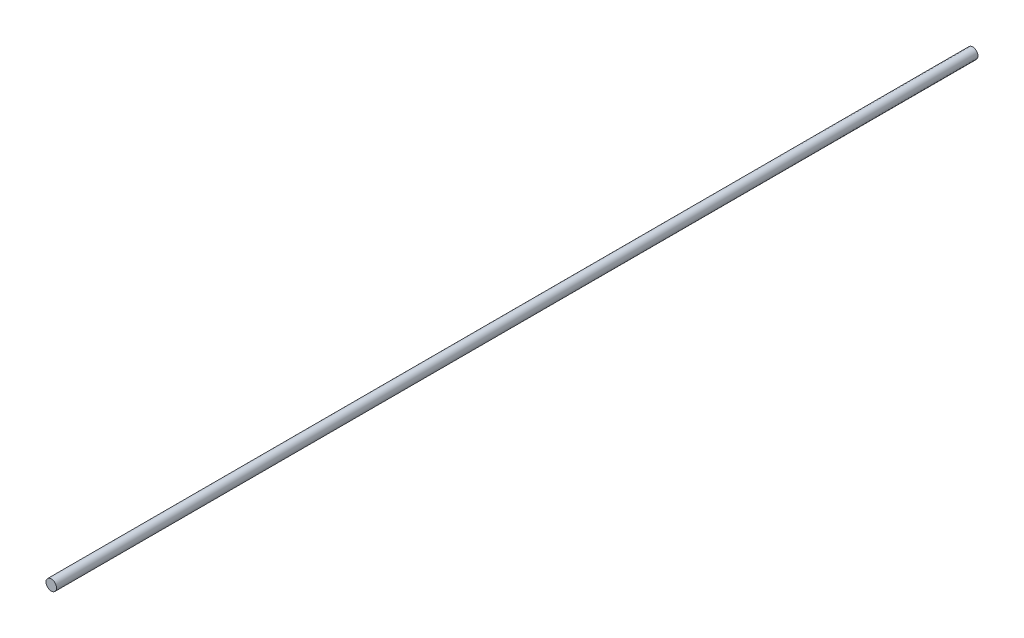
SolidWorks part; units mm, degrees
ref_plane "Front Plane" through (0, 0, 0) normal (0, 0, 1) x (1, 0, 0)
ref_plane "Top Plane" through (0, 0, 0) normal (0, 1, 0) x (1, 0, 0)
ref_plane "Right Plane" through (0, 0, 0) normal (1, 0, 0) x (0, 0, -1)
sketch "Sketch1" plane through (0, 0, 0) normal (0, 0, 1) x (1, 0, 0)
  circle A0 centre (-26.2423, 13.78) radius 4
extrude "Boss-Extrude1" add sketch "Sketch1" along normal blind 700
